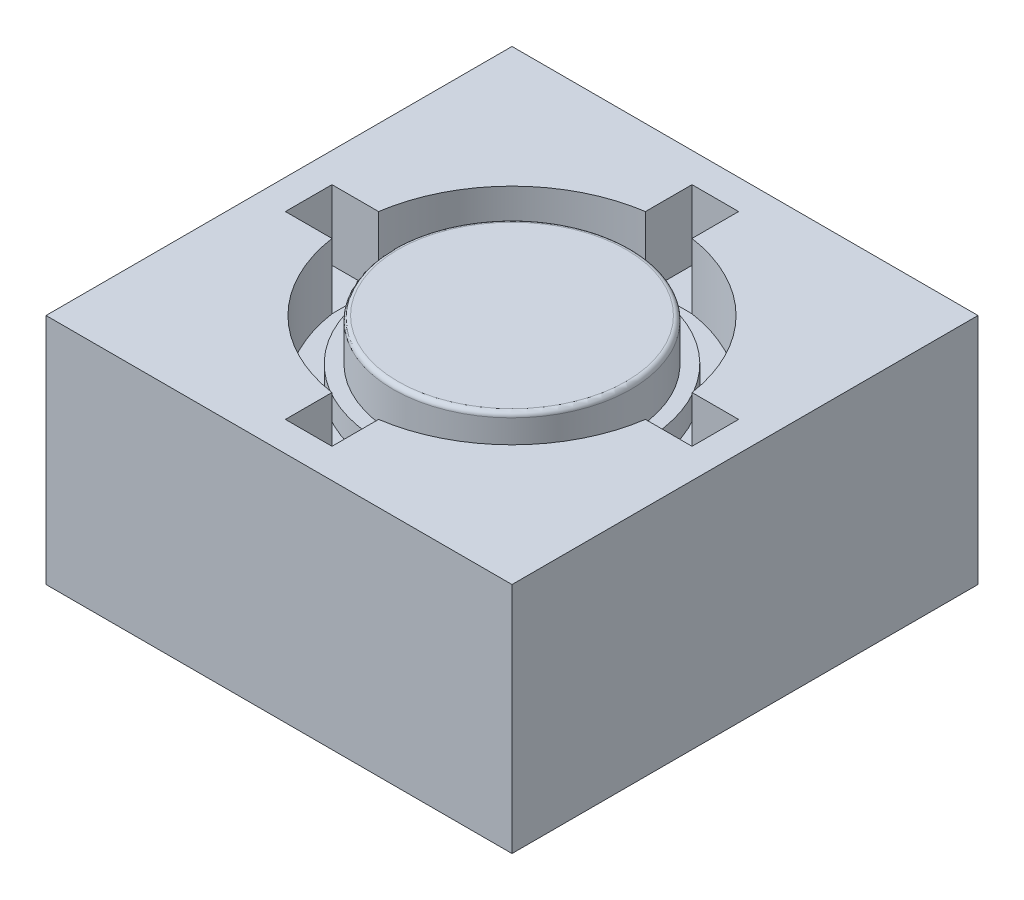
SolidWorks part; units mm, degrees
ref_plane "Front Plane" through (0, 0, 0) normal (0, 0, 1) x (1, 0, 0)
ref_plane "Top Plane" through (0, 0, 0) normal (0, 1, 0) x (1, 0, 0)
ref_plane "Right Plane" through (0, 0, 0) normal (1, 0, 0) x (0, 0, -1)
sketch "Sketch1" plane through (0, 0, 0) normal (0, 1, 0) x (1, 0, 0)
  line L1 (-10, 10) -> (10, 10)
  line L2 (-10, 10) -> (-10, -10)
  line L3 (-10, -10) -> (10, -10)
  line L4 (10, 10) -> (10, -10)
  dimension "D1" = 20
  dimension "D2" = 20
  dimension "D3" = 10
  dimension "D4" = 10
extrude "Boss-Extrude1" add sketch "Sketch1" along normal blind 10
sketch "Sketch3" plane through (0, 10, 0) normal (0, 1, 0) x (1, 0, 0)
  circle A0 centre (0, 0) radius 6.8
  circle A1 centre (0, 0) radius 5.1
  dimension "D1" = 13.6
  dimension "D2" = 10.2
extrude "Cut-Extrude1" cut sketch "Sketch3" against normal blind 2.8
fillet "Fillet1" radius 0.2 1 edges at (0, 10, 5.1)
sketch "Sketch5" plane through (0, 7.2, 0) normal (0, 1, 0) x (1, 0, 0)
  circle A0 centre (0, 0) radius 5.7
  dimension "D1" = 11.4
extrude "Boss-Extrude2" add sketch "Sketch5" along normal blind 1
sketch "Sketch6" plane through (0, 10, 0) normal (0, 1, 0) x (1, 0, 0)
  line L1 (-1, 8.7261) -> (1, 8.7261)
  line L2 (-1, 8.7261) -> (-1, 6.7261)
  line L3 (-1, 6.7261) -> (1, 6.7261)
  line L4 (1, 8.7261) -> (1, 6.7261)
  line L5 (-1, -6.7261) -> (1, -6.7261)
  line L6 (-1, -6.7261) -> (-1, -8.7261)
  line L7 (-1, -8.7261) -> (1, -8.7261)
  line L8 (1, -6.7261) -> (1, -8.7261)
  circle A0 centre (0, 0) radius 6.8 construction
  dimension "D1" = 1
  dimension "D2" = 2
  dimension "D3" = 1
  dimension "D4" = 2
  dimension "D5" = 2
  dimension "D6" = 2
extrude "Cut-Extrude2" cut sketch "Sketch6" against normal blind 3
sketch "Sketch7" plane through (0, 0, 0) normal (0, 0, 1) x (1, 0, 0)
  line L0 (0, 0) -> (0, 12.3386) construction
pattern_circular "CirPattern1" count 2 every 90 about axis through (0, 0, 0) along (0, 1, 0) of "Cut-Extrude2"
